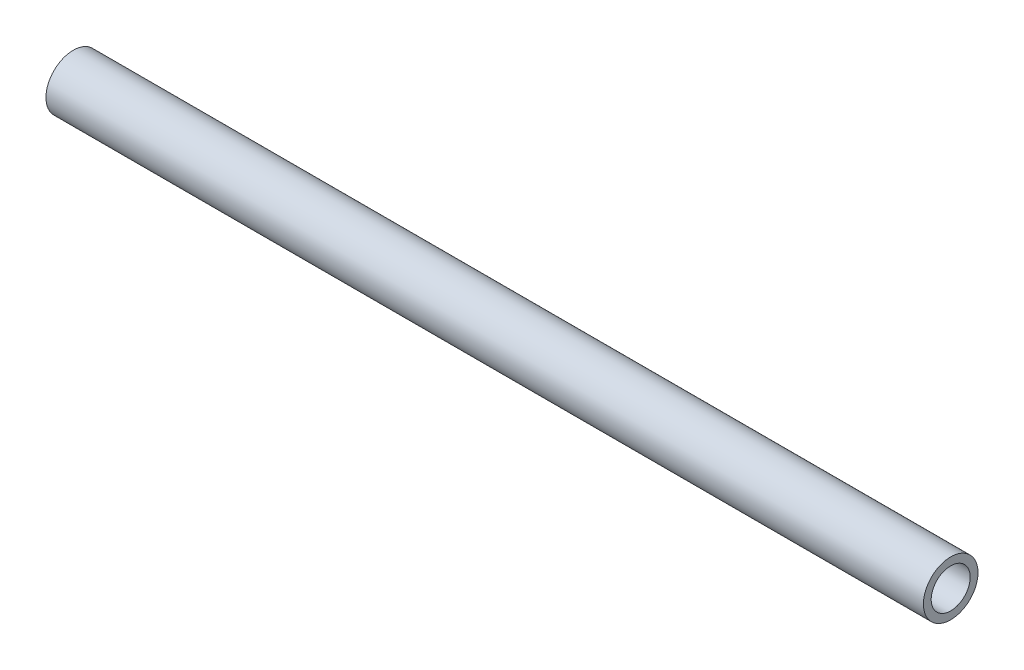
SolidWorks part; units mm, degrees
ref_plane "Front" through (0, 0, 0) normal (0, 0, 1) x (1, 0, 0)
ref_plane "Top" through (0, 0, 0) normal (0, 1, 0) x (1, 0, 0)
ref_plane "Right" through (0, 0, 0) normal (1, 0, 0) x (0, 0, -1)
sketch "Sketch1" plane through (0, 0, 0) normal (0, 0, 1) x (1, 0, 0)
  line L0 (0, 0) -> (342.9, 0)
  line L1 (9.9848, 0) -> (-9.9848, 0) construction
  dimension "D1" = 342.9
other "Structural Member1"
ref_plane "Plane1" through (0, 0, 0) normal (1, 0, 0) x (0, 0, -1)
sketch "Sketch11" plane through (0, 0, 0) normal (1, 0, 0) x (0, 0, -1)
  circle A0 centre (0, 0) radius 7.62
  circle A1 centre (0, 0) radius 10.668
  point P3 (0, 0)
  dimension "D1" = 21.336
  dimension "D2" = 15.24
